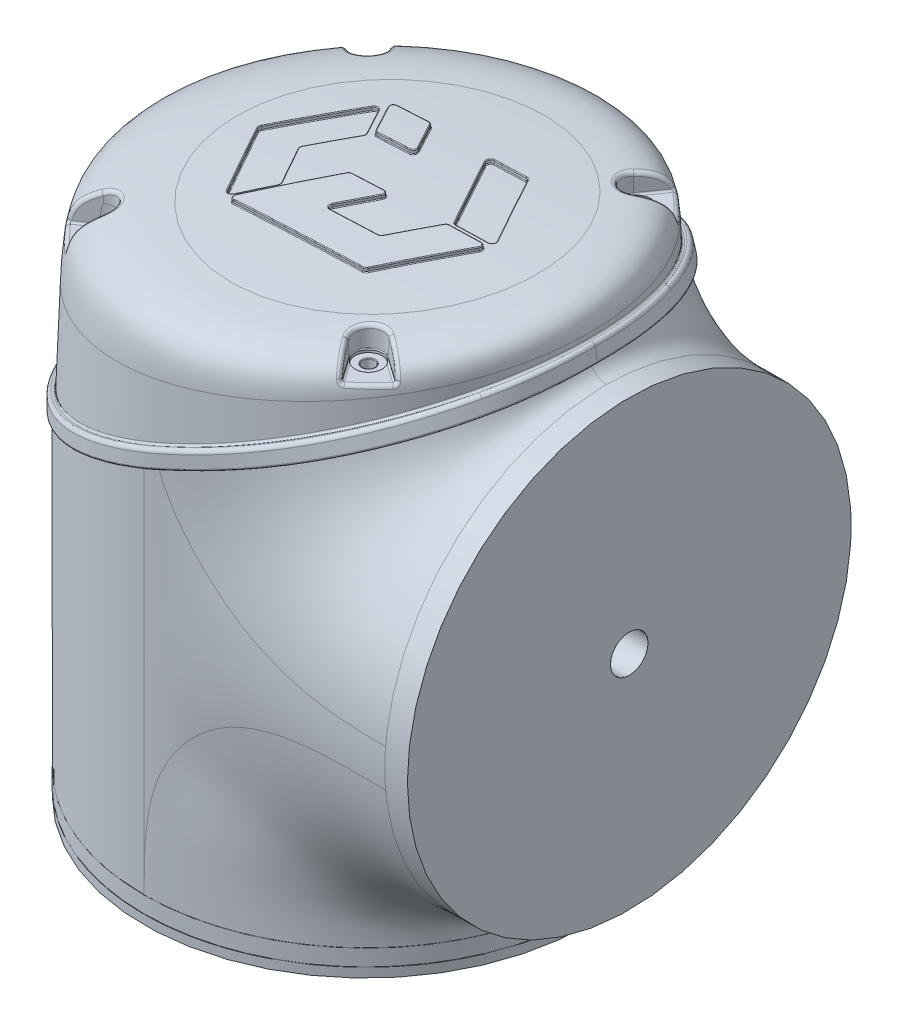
SolidWorks part; units mm, degrees
ref_plane "前视基准面" through (0, 0, 0) normal (0, 0, 1) x (1, 0, 0)
ref_plane "上视基准面" through (0, 0, 0) normal (0, 1, 0) x (1, 0, 0)
ref_plane "右视基准面" through (0, 0, 0) normal (1, 0, 0) x (0, 0, -1)
imported_body "ERJ-25关节-固定部分-1/ELITE040060-002(II)大关节-1-solid1"
imported_body "ERJ-25关节-固定部分-1/ELITE040060-016大关节过度环-1-solid1"
imported_body "ERJ-25关节-固定部分-1/17001050004--ELITE040060-017-大关节橡胶圈-1-solid1"
imported_body "ERJ-25关节-固定部分-1/25关节后盖-EC-1-solid1"
sketch "草图1" plane through (0, 14.6163, 0) normal (0, -1, 0) x (1, 0, 0)
  circle A0 centre (54.218, 0) radius 57.5
  dimension "D1" = 115
extrude "凸台-拉伸1" add sketch "草图1" against normal blind 100
sketch "草图2" plane through (124.218, 0, 0) normal (1, 0, 0) x (0, 0, -1)
  circle A0 centre (0, 82.6163) radius 58
  dimension "D1" = 116
extrude "凸台-拉伸2" add sketch "草图2" against normal blind 70
sketch "草图4" plane through (0, 14.6163, 0) normal (0, -1, 0) x (1, 0, 0)
  circle A0 centre (54.218, 0) radius 5
  dimension "D1" = 10
extrude "切除-拉伸1" cut sketch "草图4" against normal blind 10
sketch "草图5" plane through (124.218, 0, 0) normal (1, 0, 0) x (0, 0, -1)
  circle A0 centre (0, 82.6163) radius 5
  dimension "D1" = 10
extrude "切除-拉伸2" cut sketch "草图5" against normal blind 10
surface "曲面填充5"
surface "曲面填充6"
surface "曲面填充7"
surface "曲面填充8"
sketch "草图7" plane through (0, 0, 0) normal (0, 0, 1) x (1, 0, 0)
  circle A0 centre (55.6007, 0) radius 249.0226
extrude "凸台-拉伸3" add sketch "草图7" along normal mid plane 280 separate body
other "相交1"
delete or keep bodies "实体-删除/保留 1" type delete bodies bodies 120 122 121 123
